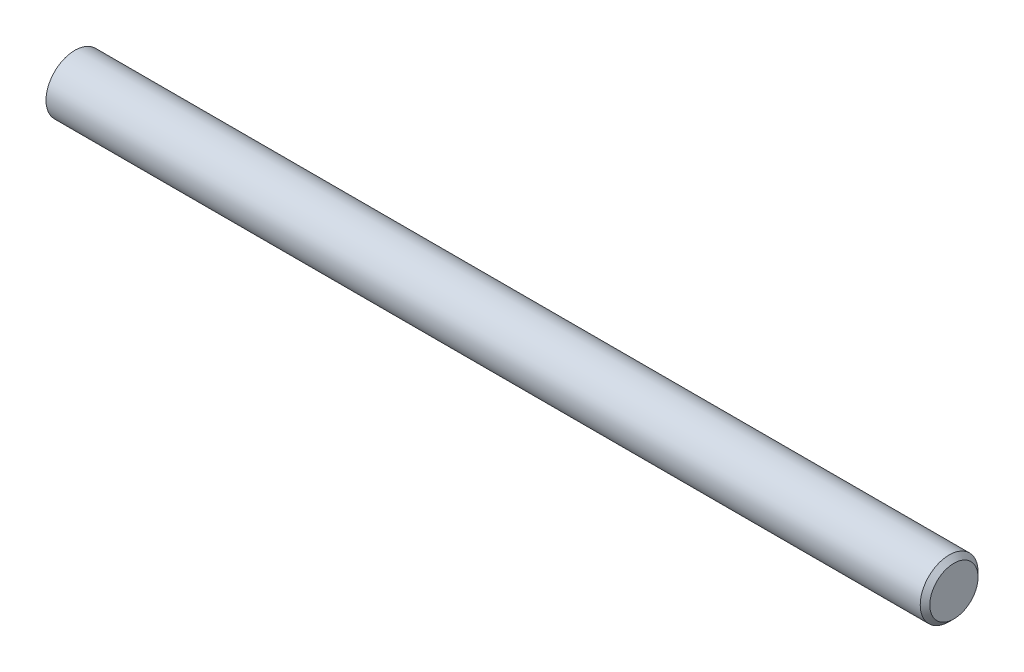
SolidWorks part; units mm, degrees
ref_plane "Plane1" through (0, 0, 0) normal (0, 0, 1) x (1, 0, 0)
ref_plane "Plane2" through (0, 0, 0) normal (0, 1, 0) x (1, 0, 0)
ref_plane "Plane3" through (0, 0, 0) normal (1, 0, 0) x (0, 0, -1)
sketch "BodySke" plane through (0, 0, 0) normal (0, 0, 1) x (1, 0, 0)
  line L0 (0, 0) -> (0, 5)
  line L3 (0, 5) -> (151.172, 5)
  line L4 (152, 4.172) -> (152, 0)
  line L5 (152, 0) -> (0, 0)
  line L6 (-31.75, 0) -> (127, 0) construction
  line L8 (152, 4.172) -> (151.172, 5)
  line L10 (152, -4.172) -> (151.172, -5) construction
  line L11 (1.5, 4.525) -> (1.5, -1.825) construction
  line L12 (107, 4.525) -> (107, -1.825) construction
  line L13 (92, 4.525) -> (92, -1.825) construction
  dimension "Diameter" = 10
  dimension "Length" = 152
  dimension "Body_ch_ang" = 45
  dimension "Minor_dia" = 8.344
  dimension "Advance" = 1.5
  dimension "Thread_nom" = 45
  dimension "Thread_length" = 60
revolve "Base-Revolve" add sketch "BodySke" angle 360 about L6
sketch "ThdSchSke" plane through (0, 0, 0) normal (0, 0, 1) x (1, 0, 0)
  line L0 (107, -4.172) -> (106.4202, -5)
  line L1 (107, -4.172) -> (107.5798, -5)
  line L2 (107.5798, -5) -> (107.5798, -6.25)
  line L3 (-3.175, 0) -> (5.1513, 0) construction
  line L5 (107.5798, -6.25) -> (106.4202, -6.25)
  line L6 (106.4202, -6.25) -> (106.4202, -5)
  dimension "Thread_minor" = 8.344
  dimension "Diameter" = 10
  dimension "Start" = 107
  dimension "SideAngle" = 55
  dimension "VeeAngle" = 70
  dimension "Overcut" = 12.5
revolve "ThreadSchematic" [suppressed] cut sketch "ThdSchSke" angle 360 about L3
pattern_linear "ThdSchPat" [suppressed]
equation "\"Thread_minor@ThreadCosmetic\"  =  \"Minor_dia@BodySke\""
equation "\"Thread_length@ThreadCosmetic\" = ((sgn( (\"Length@BodySke\" - \"Advance@BodySke\" * 3.0) - \"Thread_nom@BodySke\" )-1)*( (\"Length@BodySke\" - \"Advance@BodySke\" * 3.0) - \"Thread_nom@BodySke\" ))/-2+ \"Thread_no"
equation "\"Thread_minor@ThdSchSke\" = \"Minor_dia@BodySke\""
equation "\"Diameter@ThdSchSke\" = \"Diameter@BodySke\""
equation "\"Overcut@ThdSchSke\" = \"Diameter@BodySke\" * 1.25"
equation "\"Start@ThdSchSke\" =  \"Length@BodySke\" - \"Thread_length@ThreadCosmetic\"    '---Non-countersunk---"
equation "\"Num_threads@ThdSchPat\" = int( \"Thread_length@ThreadCosmetic\" / \"Advance@BodySke\" + 0.999 )  + 1"
equation "\"Advance@ThdSchPat\" = \"Thread_length@ThreadCosmetic\" /  (\"Num_threads@ThdSchPat\" - 1) 'relax it"
equation "\"Num_threads@ThdSchPat\" = \"Num_threads@ThdSchPat\" - sgn( \"Num_threads@ThdSchPat\" - 1) '---chamfered tips only---"
